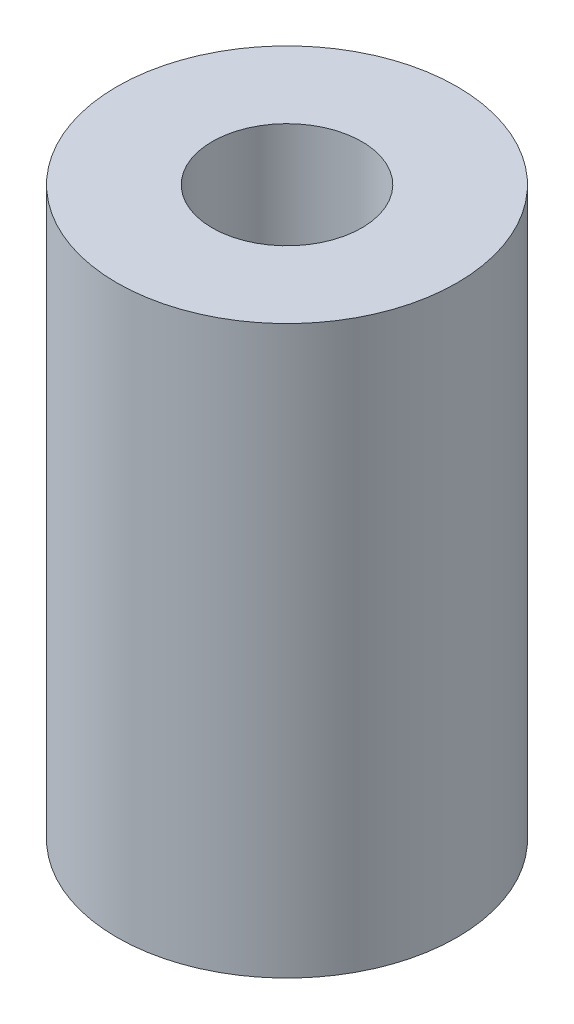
SolidWorks part; units mm, degrees
ref_plane "Front Plane" through (0, 0, 0) normal (0, 0, 1) x (1, 0, 0)
ref_plane "Top Plane" through (0, 0, 0) normal (0, 1, 0) x (1, 0, 0)
ref_plane "Right Plane" through (0, 0, 0) normal (1, 0, 0) x (0, 0, -1)
sketch "Sketch1" plane through (0, 0, 0) normal (0, 1, 0) x (1, 0, 0)
  circle A0 centre (0, 0) radius 3.3
  circle A1 centre (0, 0) radius 7.5
  dimension "D1" = 6.6
  dimension "D2" = 15
extrude "Boss-Extrude1" add sketch "Sketch1" along normal blind 25
